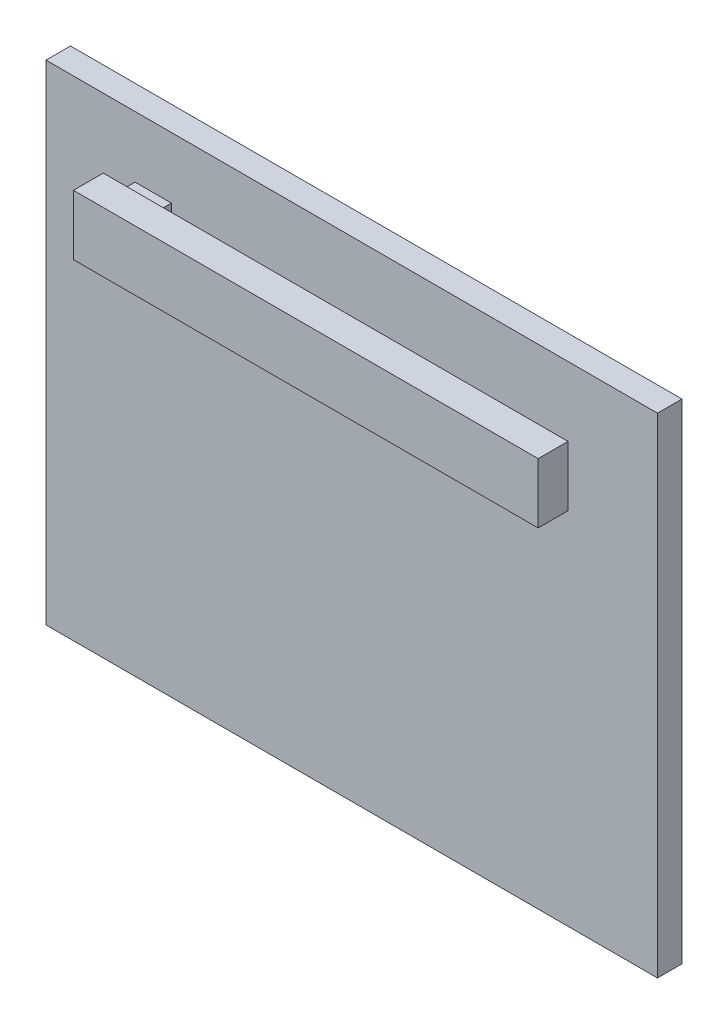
SolidWorks part; units mm, degrees
ref_plane "Front Plane" through (0, 0, 0) normal (0, 0, 1) x (1, 0, 0)
ref_plane "Top Plane" through (0, 0, 0) normal (0, 1, 0) x (1, 0, 0)
ref_plane "Right Plane" through (0, 0, 0) normal (1, 0, 0) x (0, 0, -1)
sketch "Sketch1" plane through (0, 0, 0) normal (0, 0, 1) x (1, 0, 0)
  line L1 (-25, 20) -> (25, 20)
  line L2 (-25, 20) -> (-25, -20)
  line L3 (-25, -20) -> (25, -20)
  line L4 (25, 20) -> (25, -20)
  line L5 (-25, 20) -> (25, -20) construction
  line L6 (-25, -20) -> (25, 20) construction
  point P0 (0, 0)
  dimension "D1" = 50
  dimension "D2" = 40
extrude "Boss-Extrude1" add sketch "Sketch1" along normal blind 2
sketch "Sketch2" plane through (0, 0, 2) normal (0, 0, 1) x (1, 0, 0)
  line L1 (-17.7182, 15.0014) -> (-14.7482, 15.0014)
  line L2 (-17.7182, 15.0014) -> (-17.7182, 12.0314)
  line L3 (-17.7182, 12.0314) -> (-14.7482, 12.0314)
  line L4 (-14.7482, 15.0014) -> (-14.7482, 12.0314)
  dimension "D1" = 2.97
  dimension "D2" = 2.97
extrude "Boss-Extrude2" add sketch "Sketch2" along normal blind 2.6
sketch "Sketch4" plane through (-17.7182, 0, 0) normal (-1, 0, 0) x (0, 0, 1)
  line L1 (4.6, 12.0314) -> (7.04, 12.0314)
  line L3 (4.6, 16.9414) -> (7.04, 16.9414)
  line L4 (7.04, 12.0314) -> (7.04, 16.9414)
  line L5 (4.6, 16.9414) -> (4.6, 12.0314)
  dimension "D1" = 2.44
extrude "Boss-Extrude4" add sketch "Sketch4" along normal blind 1 and the other way blind 38
sketch "Sketch5" plane through (0, 16.9414, 0) normal (0, 1, 0) x (1, 0, 0)
  line L0 (20.2818, -7.04) -> (-18.7182, -7.04) construction
  line L1 (-18.7182, -4.6) -> (-17.7194, -4.6)
  line L2 (-18.7182, -4.6) -> (-18.7182, -7.04)
  line L3 (-18.7182, -7.04) -> (-17.7194, -7.04)
  line L4 (-17.7194, -4.6) -> (-17.7194, -7.04)
extrude "Cut-Extrude1" cut sketch "Sketch5" against normal blind 10
